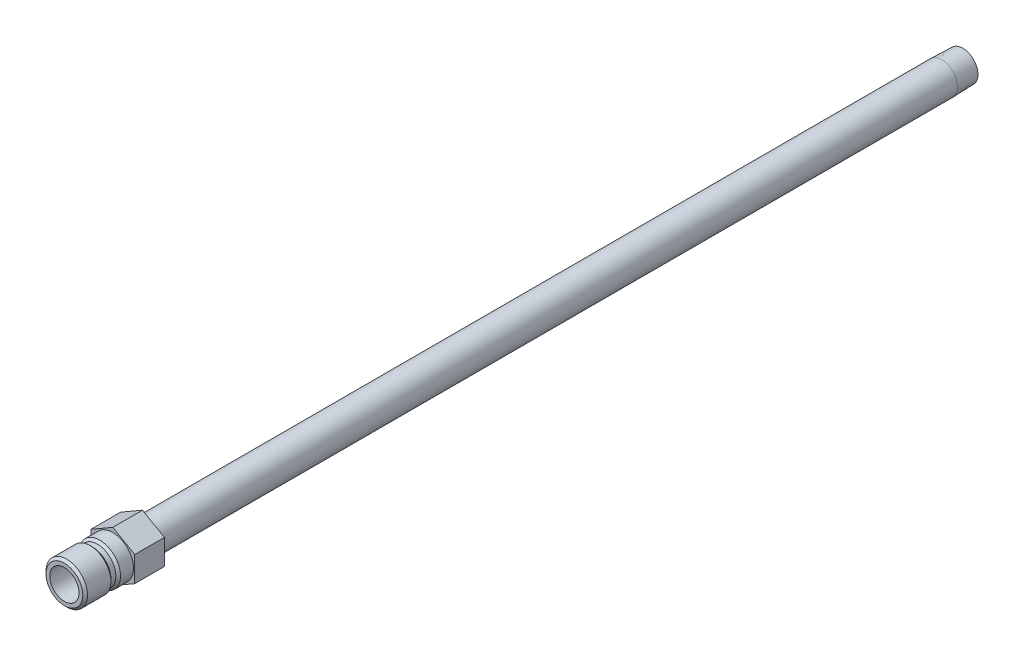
SolidWorks part; units mm, degrees
ref_plane "Front Plane" through (0, 0, 0) normal (0, 0, 1) x (1, 0, 0)
ref_plane "Top Plane" through (0, 0, 0) normal (0, 1, 0) x (1, 0, 0)
ref_plane "Right Plane" through (0, 0, 0) normal (1, 0, 0) x (0, 0, -1)
sketch "Sketch1" plane through (0, 0, 0) normal (1, 0, 0) x (0, 0, -1)
  line L0 (9.652, 0) -> (-18.923, 0) construction
  line L1 (-15.748, 4.7625) -> (-15.748, 5.9817)
  line L2 (-6.604, 5.9817) -> (-6.604, 0) construction
  line L3 (-14.986, 6.7437) -> (-7.366, 6.7437)
  line L4 (9.652, 5.1435) -> (9.652, 0) construction
  line L5 (-6.604, 5.9817) -> (-5.0165, 5.9817)
  line L6 (-4.2545, 6.7437) -> (9.652, 6.7437)
  line L7 (9.652, 6.7437) -> (9.652, 5.1435)
  line L8 (-6.604, 5.9817) -> (-7.366, 6.7437)
  line L9 (-5.0165, 5.9817) -> (-4.2545, 6.7437)
  line L10 (-15.748, 5.9817) -> (-14.986, 6.7437)
  line L11 (-15.748, 4.7625) -> (-3.556, 4.7625)
  line L12 (9.652, 5.1435) -> (269.494, 5.1435)
  line L13 (269.494, 5.1435) -> (276.352, 4.9292)
  line L14 (276.352, 4.9292) -> (276.352, 3.4163)
  line L15 (0, 0) -> (0, 6.7437) construction
  line L16 (9.652, 6.731) -> (9.652, 0) construction
  line L17 (-3.556, 4.7625) -> (-2.8402, 3.4163)
  line L19 (-2.8402, 3.4163) -> (276.352, 3.4163)
  dimension "D2" = 1.5875
  dimension "D3" = 0.762
  dimension "D4" = 45
  dimension "D5" = 9.144
  dimension "D6" = 45
  dimension "D7" = 1.79
  dimension "D8" = 6.858
  dimension "D9" = 292.1
  dimension "D10" = 3.175
  dimension "D11" = 9.525
  dimension "D12" = 10.287
  dimension "D13" = 25.4
  dimension "D14" = 13.4874
  dimension "D15" = 6.8326
  dimension "D16" = 12.192
  dimension "D17" = 9.652
  dimension "D18" = 118
revolve "Revolve1" add sketch "Sketch1" angle 360 about L0
sketch "Sketch2" plane through (0, 0, 0) normal (0, 0, 1) x (1, 0, 0)
  line L1 (-7.112, 4.1061) -> (-7.112, -4.1061)
  line L2 (-7.112, -4.1061) -> (0, -8.2122)
  line L3 (0, -8.2122) -> (7.112, -4.1061)
  line L4 (7.112, -4.1061) -> (7.112, 4.1061)
  line L5 (7.112, 4.1061) -> (0, 8.2122)
  line L6 (0, 8.2122) -> (-7.112, 4.1061)
  circle A0 centre (0, 0) radius 7.112 construction
  circle A1 centre (0, 0) radius 4.7625 construction
  circle A2 centre (0, 0) radius 4.7625
  dimension "D1" = 14.224
extrude "Boss-Extrude1" add sketch "Sketch2" against normal up to vertex (9.652 mm away)
